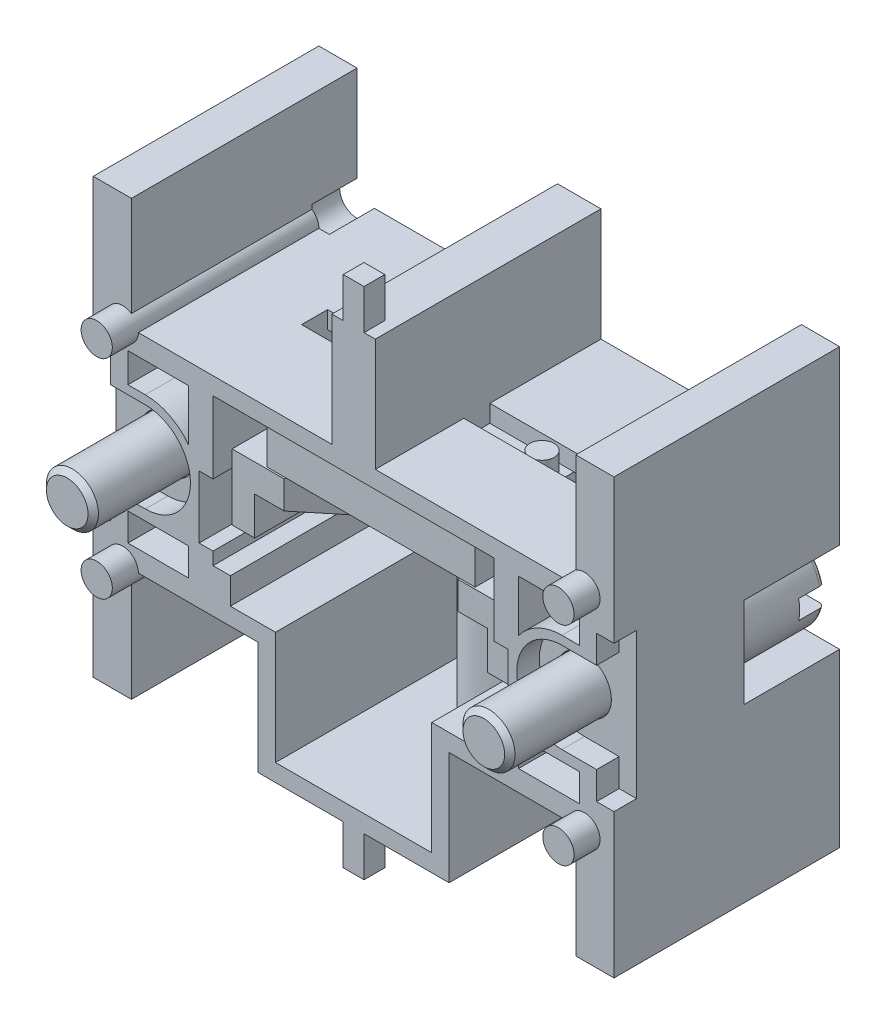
SolidWorks part; units mm, degrees
ref_plane "Спереди" through (0, 0, 0) normal (0, 0, 1) x (1, 0, 0)
ref_plane "Сверху" through (0, 0, 0) normal (0, 1, 0) x (1, 0, 0)
ref_plane "Справа" through (0, 0, 0) normal (1, 0, 0) x (0, 0, -1)
sketch "Эскиз1" plane through (0, 0, 0) normal (0, 0, 1) x (1, 0, 0)
  line L1 (-15, -6) -> (15, -6)
  line L2 (-15, -6) -> (-15, 6)
  line L3 (-15, 6) -> (15, 6)
  line L4 (15, -6) -> (15, 6)
  dimension "D1" = 30
  dimension "D2" = 15
  dimension "D3" = 12
  dimension "D4" = 6
extrude "Бобышка-Вытянуть1" add sketch "Эскиз1" along normal blind 13
sketch "Эскиз2" plane through (0, 0, 13) normal (0, 0, 1) x (1, 0, 0)
  line L1 (-15, -6) -> (-12.8, -6)
  line L2 (-15, -6) -> (-15, -12.5)
  line L3 (-15, -12.5) -> (-12.8, -12.5)
  line L4 (-12.8, -6) -> (-12.8, -12.5)
  line L5 (-15, 6) -> (-12.8, 6)
  line L6 (-15, 6) -> (-15, 12.5)
  line L7 (-15, 12.5) -> (-12.8, 12.5)
  line L8 (-12.8, 6) -> (-12.8, 12.5)
  line L9 (15, -6) -> (12.8, -6)
  line L10 (15, -6) -> (15, -12.5)
  line L11 (15, -12.5) -> (12.8, -12.5)
  line L12 (12.8, -6) -> (12.8, -12.5)
  line L13 (15, 6) -> (12.8, 6)
  line L14 (15, 6) -> (15, 12.5)
  line L15 (15, 12.5) -> (12.8, 12.5)
  line L16 (12.8, 6) -> (12.8, 12.5)
  dimension "D1" = 12.5
  dimension "D2" = 12.5
  dimension "D3" = 12.5
  dimension "D4" = 12.5
  dimension "D5" = 2.2
  dimension "D6" = 2.2
  dimension "D7" = 2.2
  dimension "D8" = 2.2
extrude "Бобышка-Вытянуть2" add sketch "Эскиз2" against normal blind 13
sketch "Эскиз3" plane through (0, 0, 13) normal (0, 0, 1) x (1, 0, 0)
  line L1 (-5.5, -5.3069) -> (5.5, -5.3069)
  line L2 (-5.5, -5.3069) -> (-5.5, -12.5)
  line L3 (-5.5, -12.5) -> (5.5, -12.5)
  line L4 (5.5, -5.3069) -> (5.5, -12.5)
  line L5 (-1.25, 4.6035) -> (1.25, 4.6035)
  line L6 (-1.25, 4.6035) -> (-1.25, 12.5)
  line L7 (-1.25, 12.5) -> (1.25, 12.5)
  line L8 (1.25, 4.6035) -> (1.25, 12.5)
  dimension "D1" = 11
  dimension "D2" = 2.5
  dimension "D3" = 1.25
  dimension "D4" = 5.5
  dimension "D5" = 12.5
  dimension "D6" = 12.5
extrude "Бобышка-Вытянуть3" add sketch "Эскиз3" against normal blind 13
sketch "Эскиз4" plane through (0, 0, 13) normal (0, 0, 1) x (1, 0, 0)
  line L0 (4.5, -11.5) -> (4.5, -5)
  line L1 (4.5, -5) -> (7.1, -5)
  line L2 (7.1, -5) -> (7.1, -3.4792)
  line L3 (7.1, -3.4792) -> (8.1, -3.4792)
  line L4 (8.1, -3.4792) -> (8.1, 5)
  line L5 (8.1, 5) -> (-8.1, 5)
  line L6 (-8.1, 5) -> (-8.1, -3.4792)
  line L7 (-8.1, -3.4792) -> (-7.1, -3.4792)
  line L8 (-7.1, -3.4792) -> (-7.1, -5)
  line L9 (-7.1, -5) -> (-4.5, -5)
  line L10 (-4.5, -5) -> (-4.5, -11.5)
  line L11 (-4.5, -11.5) -> (4.5, -11.5)
  line L12 (-5.5, -6) -> (-5.5, -12.5) construction
  dimension "D1" = 1
  dimension "D2" = 1
  dimension "D3" = 1
  dimension "D4" = 1
  dimension "D5" = 1
  dimension "D6" = 14.2
  dimension "D7" = 7.1
  dimension "D8" = 1
  dimension "D9" = 16.2
  dimension "D10" = 8.1
extrude "Вырез-Вытянуть1" cut sketch "Эскиз4" against normal blind 11.5
sketch "Эскиз5" plane through (0, 0, 13) normal (0, 0, 1) x (1, 0, 0)
  line L0 (0, 0) -> (-16.0402, 0) construction
  line L1 (0, 0) -> (16.0839, 0) construction
  line L2 (15, -12.5) -> (15, 12.5) construction
  line L3 (15, -4.2) -> (14, -4.2)
  line L4 (15, -4.2) -> (15, 4.2)
  line L5 (15, 4.2) -> (14, 4.2)
  line L6 (14, -4.2) -> (14, -2.6)
  line L7 (12, -2.6) -> (14, -2.6)
  line L8 (12, 2.6) -> (14, 2.6)
  line L9 (14, 2.6) -> (14, 4.2)
  arc A0 (12, 2.6) -> (12, -2.6) centre (12, 0) ccw
  dimension "D2" = 5.2
  dimension "D1" = 12
  dimension "D3" = 8.4
  dimension "D4" = 4.2
  dimension "D5" = 1
extrude "Вырез-Вытянуть2" cut sketch "Эскиз5" against normal blind 1.3
mirror "Зеркальное отражение1" about plane through (0, 0, 0) normal (1, 0, 0) of "Вырез-Вытянуть2"
sketch "Эскиз6" plane through (0, 0, 0) normal (0, 0, -1) x (-1, 0, 0)
  line L0 (-14, 2.6) -> (-12, 2.6) construction
  line L1 (-14, 2.6) -> (-12, 2.6)
  line L2 (-12, -2.6) -> (-14, -2.6) construction
  line L3 (-12, -2.6) -> (-14, -2.6)
  line L5 (-14, 2.6) -> (-17.7741, 2.6)
  line L6 (-17.7741, 2.6) -> (-17.7741, -2.6)
  line L7 (-17.7741, -2.6) -> (-14, -2.6)
  arc A0 (-12, -2.6) -> (-12, 2.6) centre (-12, 0) ccw construction
  arc A1 (-12, -2.6) -> (-12, 2.6) centre (-12, 0) ccw
extrude "Вырез-Вытянуть3" cut sketch "Эскиз6" against normal blind 5.5
mirror "Зеркальное отражение2" about plane through (0, 0, 0) normal (1, 0, 0) of "Вырез-Вытянуть3"
sketch "Эскиз7" plane through (0, 0, 5.5) normal (0, 0, -1) x (-1, 0, 0)
  circle A0 centre (-12, 0) radius 1.55
  dimension "D1" = 3.1
extrude "Вырез-Вытянуть4" cut sketch "Эскиз7" against normal blind 7
mirror "Зеркальное отражение3" about plane through (0, 0, 0) normal (1, 0, 0) of "Вырез-Вытянуть4"
sketch "Эскиз8" plane through (0, 0, 0) normal (0, 0, -1) x (-1, 0, 0)
  line L0 (-4.2, 1.2) -> (-2, 1.2)
  line L1 (-8.9, -2.75) -> (-4.2, -2.75)
  line L2 (-8.9, -2.75) -> (-8.9, 0.85)
  line L3 (-8.1, 2.75) -> (-4.2, 2.75)
  line L4 (-4.2, -2.75) -> (-4.2, -1.2)
  line L5 (-2, 1.2) -> (-2, -1.2)
  line L6 (-2, -1.2) -> (-4.2, -1.2)
  line L7 (-4.2, 1.2) -> (-4.2, 2.75)
  line L10 (-8.9, 0.85) -> (-8.1, 0.85)
  line L11 (-8.1, 2.75) -> (-8.1, 0.85)
  arc A0 (-12, -2.6) -> (-12, 2.6) centre (-12, 0) ccw construction
  point P4 (-9.4, 0)
  dimension "D1" = 0.5
  dimension "D2" = 0.8
  dimension "D3" = 2.75
  dimension "D5" = 2.4
  dimension "D6" = 1.2
  dimension "D7" = 2.2
  dimension "D8" = 3.6
extrude "Вырез-Вытянуть5" cut sketch "Эскиз8" against normal through all
fillet "Скругление1" radius 1.2 2 edges at (2, 1.2, 0.75) (2, -1.2, 0.75)
mirror "Зеркальное отражение4" about plane through (0, 0, 0) normal (1, 0, 0) of "Вырез-Вытянуть5", "Скругление1"
sketch "Эскиз10" plane through (0, 0, 13) normal (0, 0, 1) x (1, 0, 0)
  line L0 (1.25, 12.5) -> (-1.25, 12.5) construction
  line L1 (0.6, 12.5) -> (-0.6, 12.5)
  line L2 (0.6, 12.5) -> (0.6, 14.8)
  line L3 (0.6, 14.8) -> (-0.6, 14.8)
  line L4 (-0.6, 12.5) -> (-0.6, 14.8)
  dimension "D1" = 1.2
  dimension "D2" = 0.6
  dimension "D3" = 2.3
extrude "Бобышка-Вытянуть4" add sketch "Эскиз10" against normal blind 1.2
mirror "Зеркальное отражение5" about plane through (0, 0, 0) normal (0, 1, 0) of "Бобышка-Вытянуть4"
sketch "Эскиз11" plane through (0, 0, 0) normal (0, 0, -1) x (-1, 0, 0)
  circle A0 centre (-12.8, -6) radius 1
  circle A1 centre (-12.8, 6) radius 1
  circle A2 centre (12.8, -6) radius 1
  circle A3 centre (12.8, 6) radius 1
  dimension "D1" = 2
extrude "Вырез-Вытянуть6" cut sketch "Эскиз11" against normal blind 2.6
sketch "Эскиз12" plane through (0, 0, 13) normal (0, 0, 1) x (1, 0, 0)
  circle A0 centre (-13.3, -6) radius 0.9
  circle A1 centre (-13.3, 6) radius 0.9
  dimension "D4" = 1.8
  dimension "D6" = 1.8
  dimension "D1" = 12
  dimension "D2" = 6
  dimension "D3" = 0.5
  dimension "D5" = 0.5
extrude "Бобышка-Вытянуть5" add sketch "Эскиз12" along normal blind 1.5 and the other way up to surface
mirror "Зеркальное отражение6" about plane through (0, 0, 0) normal (1, 0, 0) of "Бобышка-Вытянуть5"
sketch "Эскиз14" plane through (0, 6, 0) normal (0, 1, 0) x (1, 0, 0)
  line L0 (1.25, 0) -> (1.25, -13) construction
  line L1 (1.25, -7.9) -> (8.1, -7.9)
  line L2 (1.25, -7.9) -> (1.25, -6.4)
  line L3 (1.25, -6.4) -> (8.1, -6.4)
  line L5 (8.1, -13) -> (8.1, 0) construction
  line L6 (8.1, -7.9) -> (8.1, -6.4)
  dimension "D1" = 6.4
  dimension "D2" = 1.5
extrude "Вырез-Вытянуть7" cut sketch "Эскиз14" against normal blind 1.5
mirror "Зеркальное отражение7" about plane through (0, 0, 0) normal (1, 0, 0) of "Вырез-Вытянуть7"
sketch "Эскиз15" plane through (0, 0, 13) normal (0, 0, 1) x (1, 0, 0)
  line L0 (8.1, 5) -> (-8.1, 5) construction
  line L1 (6, 5) -> (-6, 5)
  line L2 (6, 5) -> (6, 2)
  line L3 (6, 2) -> (-6, 2)
  line L4 (-6, 5) -> (-6, 2)
  dimension "D1" = 12
  dimension "D2" = 6
  dimension "D3" = 3
extrude "Бобышка-Вытянуть6" add sketch "Эскиз15" against normal up to surface (11.5 mm away)
sketch "Эскиз16" plane through (0, 0, 13) normal (0, 0, 1) x (1, 0, 0)
  line L0 (6, 5) -> (-6, 5)
  line L1 (-6, 5) -> (-6, 4.9)
  line L2 (-6, 5) -> (-6, 2) construction
  line L3 (-6, 4.9) -> (6.1354, 4.9)
  line L4 (6.1354, 4.9) -> (6.1354, 5)
  line L5 (8.1, 5) -> (6, 5) construction
  line L6 (6.1354, 5) -> (6, 5)
  dimension "D1" = 0.1
extrude "Вырез-Вытянуть8" cut sketch "Эскиз16" against normal up to surface (11.5 mm away)
sketch "Эскиз17" plane through (0, 0, 13) normal (0, 0, 1) x (1, 0, 0)
  line L4 (6, 2) -> (6, 4.9)
  line L5 (6, 4.9) -> (-6, 4.9)
  line L6 (-6, 4.9) -> (-6, 2)
  line L7 (-6, 2) -> (6, 2)
  line L8 (6, 2) -> (6, 4.9)
  line L9 (6, 4.9) -> (-6, 4.9)
  line L10 (-6, 4.9) -> (-6, 2)
  line L11 (-6, 2) -> (6, 2)
  dimension "D1" = 0
extrude "Вырез-Вытянуть9" cut sketch "Эскиз17" against normal blind 1
sketch "Эскиз18" plane through (0, 0, 12) normal (0, 0, 1) x (1, 0, 0)
  line L1 (8, 1.9) -> (-8, 1.9)
  line L2 (8, 1.9) -> (8, 0.75)
  line L3 (8, -1.9) -> (-8, -1.9)
  line L4 (-8, 1.9) -> (-8, 0.75)
  line L5 (-8, 0.75) -> (-8.8, 0.75)
  line L6 (8, -1.9) -> (8.8, -1.9)
  line L8 (-8.8, 0.75) -> (-8.8, -1.1271)
  line L9 (8, 0.75) -> (8.8, 0.75)
  line L12 (8.8, 0.75) -> (8.8, -1.9)
  line L13 (-8, -1.9) -> (-8.8, -1.9)
  line L14 (-8.8, -1.1271) -> (-8.8, -1.9)
  dimension "D1" = 1.9
  dimension "D2" = 1.9
  dimension "D3" = 16
  dimension "D4" = 8
  dimension "D5" = 3.8
  dimension "D6" = 0.1
  dimension "D7" = 0.8
  dimension "D10" = 0.1
extrude "Бобышка-Вытянуть7" add sketch "Эскиз18" against normal up to surface (10.5 mm away)
sketch "Эскиз19" plane through (0, 0, 12) normal (0, 0, 1) x (1, 0, 0)
  line L0 (8, 1.9) -> (-8, 1.9) construction
  line L1 (-5, 1.9) -> (5, 1.9)
  line L2 (-5, 1.9) -> (-5, -1.9)
  line L3 (-5, -1.9) -> (5, -1.9)
  line L4 (5, 1.9) -> (5, -1.9)
  line L5 (-8.8, -1.9) -> (8.8, -1.9) construction
  dimension "D1" = 10
  dimension "D2" = 5
extrude "Вырез-Вытянуть10" cut sketch "Эскиз19" against normal blind 6
sketch "Эскиз20" plane through (0, 0, 12) normal (0, 0, 1) x (1, 0, 0)
  line L0 (-8.8, -1.9) -> (-5, -1.9) construction
  line L1 (-8.8, 0.75) -> (-8, 0.75)
  line L2 (-8.8, 0.75) -> (-8.8, -1.9)
  line L3 (-8.8, -1.9) -> (-8, -1.9)
  line L4 (-8, 0.75) -> (-8, -1.9)
  dimension "D1" = 0.8
extrude "Вырез-Вытянуть11" cut sketch "Эскиз20" against normal blind 6
sketch "Эскиз21" plane through (-5, 0, 0) normal (1, 0, 0) x (0, 0, -1)
  line L0 (-12, -1.9) -> (-12, 0.3)
  line L1 (-12, 1.9) -> (-12, -1.9) construction
  line L2 (-6, -1.9) -> (-12, -1.9) construction
  line L3 (-12, 0.3) -> (-8, -1.9)
  line L4 (-8, -1.9) -> (-12, -1.9)
  dimension "D1" = 4
  dimension "D2" = 2.2
extrude "Вырез-Вытянуть12" cut sketch "Эскиз21" against normal blind 1.7
mirror "Зеркальное отражение8" about plane through (0, 0, 0) normal (1, 0, 0) of "Вырез-Вытянуть12"
sketch "Эскиз23" plane through (0, -1.9, 0) normal (0, -1, 0) x (1, 0, 0)
  line L0 (4.2, 1.5) -> (-4.2, 1.5) construction
  line L1 (1.5, 1.5) -> (-1.5, 1.5)
  arc A0 (1.5, 1.5) -> (-1.5, 1.5) centre (0, 3.5) ccw
  dimension "D1" = 5
  dimension "D2" = 2.5
extrude "Бобышка-Вытянуть8" add sketch "Эскиз23" along normal up to surface (9.6 mm away)
sketch "Эскиз24" plane through (0, 0, 1.5) normal (0, 0, -1) x (-1, 0, 0)
  line L0 (4.3, 1.9) -> (4.3, -1.9)
  line L9 (4.2, 1.9) -> (4.2, 1.2)
  line L10 (4.2, 1.2) -> (3.2, 1.2)
  line L11 (3.2, -1.2) -> (4.2, -1.2)
  line L12 (4.2, -1.2) -> (4.2, -1.9)
  line L13 (4.2, -1.9) -> (8.8, -1.9)
  line L14 (8.8, -1.9) -> (8.8, 0.75)
  line L15 (8.8, 0.75) -> (8, 0.75)
  line L16 (8, 0.75) -> (8, 1.9)
  line L17 (8, 1.9) -> (4.2, 1.9)
  line L22 (4.3, -1.9) -> (8.8, -1.9)
  line L23 (8.8, -1.9) -> (8.8, 0.75)
  line L24 (8.8, 0.75) -> (8, 0.75)
  line L25 (8, 0.75) -> (8, 1.9)
  line L26 (8, 1.9) -> (4.3, 1.9)
  arc A2 (3.2, 1.2) -> (2, 0) centre (3.2, 0) ccw
  arc A3 (2, 0) -> (3.2, -1.2) centre (3.2, 0) ccw
  dimension "D2" = 0.1
  dimension "D1" = 0
extrude "Бобышка-Вытянуть9" add sketch "Эскиз24" along normal up to surface (1.5 mm away)
mirror "Зеркальное отражение9" about plane through (0, 0, 0) normal (1, 0, 0) of "Бобышка-Вытянуть9"
sketch "Эскиз25" plane through (0, 0, 5.5) normal (0, 0, -1) x (-1, 0, 0)
  circle A0 centre (-12, 0) radius 2.5
  dimension "D1" = 5
extrude "Бобышка-Вытянуть10" add sketch "Эскиз25" along normal blind 5.2
sketch "Эскиз26" plane through (0, 0, 0.3) normal (0, 0, -1) x (-1, 0, 0)
  circle A0 centre (-12, 0) radius 1.3
  dimension "D1" = 2.6
extrude "Вырез-Вытянуть13" cut sketch "Эскиз26" against normal blind 4.2
sketch "Эскиз27" plane through (0, 0, 0.3) normal (0, 0, -1) x (-1, 0, 0)
  line L0 (-14.5, 0) -> (-9.5, 0) construction
  line L1 (-11.45, -0.55) -> (-9.5613, -0.55)
  line L2 (-11.45, 2.4387) -> (-11.45, 0.55)
  line L3 (-11.45, 0.55) -> (-9.5613, 0.55)
  line L4 (-12.55, 2.4387) -> (-12.55, 0.55)
  line L5 (-14.4387, -0.55) -> (-12.55, -0.55)
  line L6 (-12.55, -0.55) -> (-12.55, -2.4387)
  line L7 (-14.4387, 0.55) -> (-12.55, 0.55)
  line L8 (-11.45, -0.55) -> (-11.45, -2.4387)
  line L9 (-12, 2.5) -> (-12, -2.5) construction
  circle A0 centre (-12, 0) radius 2.5 construction
  circle A1 centre (-12, 0) radius 2.5 construction
  arc A2 (-11.45, 2.4387) -> (-12.55, 2.4387) centre (-12, 0) ccw
  arc A3 (-14.4387, 0.55) -> (-14.4387, -0.55) centre (-12, 0) ccw
  arc A4 (-12.55, -2.4387) -> (-11.45, -2.4387) centre (-12, 0) ccw
  arc A5 (-9.5613, -0.55) -> (-9.5613, 0.55) centre (-12, 0) ccw
extrude "Вырез-Вытянуть14" cut sketch "Эскиз27" against normal blind 1.5
sketch "Эскиз28" plane through (0, 0, 5.5) normal (0, 0, 1) x (1, 0, 0)
  circle A0 centre (12, 0) radius 1.5
  dimension "D1" = 3
extrude "Бобышка-Вытянуть11" add sketch "Эскиз28" along normal blind 12
fillet "Скругление2" radius 0.3 4 edges at (10.2322, 1.7678, 0.3) (10.2322, -1.7678, 0.3) (13.7678, -1.7678, 0.3) (13.7678, 1.7678, 0.3)
chamfer "Фаска1" distance 0.3 angle 45 1 edges at (13.5, 0, 17.5)
mirror "Зеркальное отражение11" about plane through (0, 0, 0) normal (1, 0, 0) of "Бобышка-Вытянуть10"
mirror "Зеркальное отражение12" about plane through (0, 0, 0) normal (1, 0, 0) of "Вырез-Вытянуть14", "Вырез-Вытянуть13"
fillet "Скругление3" radius 0.3 4 edges at (-13.7678, -1.7678, 0.3) (-10.2322, -1.7678, 0.3) (-10.2322, 1.7678, 0.3) (-13.7678, 1.7678, 0.3)
sketch "Эскиз29" plane through (0, 0, 13) normal (0, 0, 1) x (1, 0, 0)
  line L0 (5.5, -6) -> (12.4, -6) construction
  line L1 (9.5, -3.2) -> (13, -3.2)
  line L2 (9.5, -3.2) -> (9.5, -4.8)
  line L3 (9.5, -4.8) -> (13, -4.8)
  line L4 (13, -3.2) -> (13, -4.8)
  line L5 (14, -2.6) -> (14, -4.2) construction
  dimension "D1" = 0.6
  dimension "D2" = 1.2
  dimension "D3" = 1
  dimension "D4" = 3.5
extrude "Вырез-Вытянуть15" cut sketch "Эскиз29" against normal blind 11.5
sketch "Эскиз30" plane through (0, 0, 5.5) normal (0, 0, 1) x (1, 0, 0)
  circle A0 centre (-12, 0) radius 1.5
  dimension "D1" = 3
extrude "Бобышка-Вытянуть12" add sketch "Эскиз30" along normal blind 12
chamfer "Фаска3" distance 0.3 angle 45 1 edges at (-10.5, 0, 17.5)
sketch "Эскиз31" plane through (0, 0, 13) normal (0, 0, 1) x (1, 0, 0)
  line L2 (14, 3.1) -> (12, 3.1)
  line L3 (13, 3.1) -> (12, 3.1)
  line L4 (9.5, 4.8) -> (13, 4.8)
  line L5 (13, 4.8) -> (13, 3.1)
  line L6 (9.5, 1.833) -> (9.5, 4.8)
  arc A2 (12, 3.1) -> (12, -3.1) centre (12, 0) ccw
  arc A3 (12, 3.1) -> (9.5, 1.833) centre (12, 0) ccw
  dimension "D3" = 1.7
  dimension "D1" = 0.5
  dimension "D2" = 0.5
extrude "Вырез-Вытянуть16" cut sketch "Эскиз31" against normal blind 11.5
mirror "Зеркальное отражение15" about plane through (0, 0, 0) normal (1, 0, 0) of "Вырез-Вытянуть15", "Вырез-Вытянуть16"
sketch "Эскиз32" plane through (0, 4.9, 0) normal (0, 1, 0) x (1, 0, 0)
  line L0 (8.1, -6.4) -> (1.25, -6.4) construction
  circle A0 centre (-5, -7.15) radius 0.7
  circle A1 centre (5, -7.15) radius 0.7
  point P4 (4.675, -6.4)
  dimension "D1" = 1.4
  dimension "D2" = 0.75
  dimension "D3" = 5
  dimension "D4" = 10
  dimension "D5" = 0.75
extrude "Бобышка-Вытянуть13" add sketch "Эскиз32" along normal blind 1
